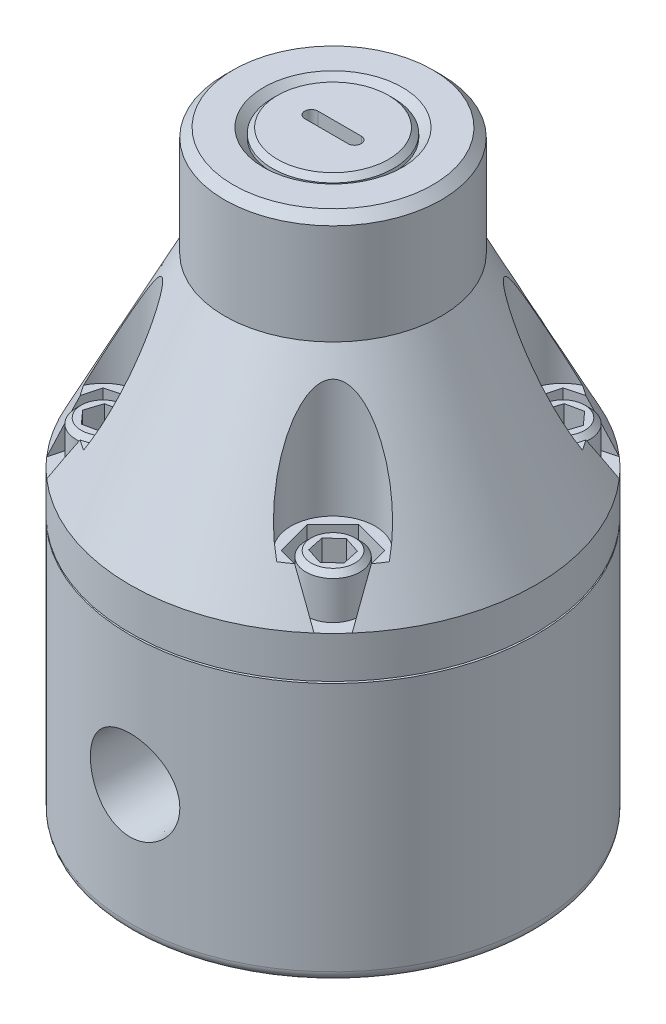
SolidWorks part; units mm, degrees
ref_plane "Front Plane" through (0, 0, 0) normal (0, 0, 1) x (1, 0, 0)
ref_plane "Top Plane" through (0, 0, 0) normal (0, 1, 0) x (1, 0, 0)
ref_plane "Right Plane" through (0, 0, 0) normal (1, 0, 0) x (0, 0, -1)
sketch "Sketch1" plane through (0, 0, 0) normal (0, 1, 0) x (1, 0, 0)
  circle A0 centre (0, 0) radius 29.718
  dimension "D1" = 59.436
extrude "Extrude1" add sketch "Sketch1" along normal blind 87.63
sketch "Sketch2" plane through (0, 0, 0) normal (0, 0, 1) x (1, 0, 0)
  line L0 (0, 0) -> (0, 87.63) construction
  line L1 (29.718, 87.63) -> (-29.718, 87.63) construction
  line L2 (-34.5439, 38.1) -> (-19.05, 38.1)
  line L3 (-19.05, 38.1) -> (-19.05, 38.354)
  line L4 (-19.05, 38.354) -> (-29.718, 38.354)
  line L5 (-15.875, 71.628) -> (-15.875, 89.2885)
  line L6 (-15.875, 89.2885) -> (-34.5439, 89.2885)
  line L7 (-34.5439, 89.2885) -> (-34.5439, 38.1)
  line L8 (-29.718, 87.63) -> (-29.718, 0) construction
  line L9 (-29.718, 38.354) -> (-29.718, 44.45)
  line L10 (-29.718, 0) -> (29.718, 0) construction
  line L11 (-29.718, 44.45) -> (-15.875, 71.628)
  dimension "D1" = 38.1
  dimension "D2" = 0.254
  dimension "D3" = 6.35
  dimension "D4" = 27.178
  dimension "D5" = 15.875
  dimension "D6" = 19.05
revolve "Cut-Revolve1" cut sketch "Sketch2" angle 360 about L0
ref_plane "Plane1" through (0, 87.63, 0) normal (0, 1, 0) x (-1, 0, 0)
sketch "Sketch3" plane through (0, 87.63, 0) normal (0, 1, 0) x (-1, 0, 0)
  circle A0 centre (0, 0) radius 10.16
  dimension "D1" = 20.32
extrude "Extrude2" cut sketch "Sketch3" against normal blind 1.27 draft 45
ref_plane "Plane2" through (0, 0, 29.718) normal (0, 0, 1) x (1, 0, 0)
sketch "Sketch4" plane through (0, 0, 29.718) normal (0, 0, 1) x (1, 0, 0)
  line L0 (0, 0) -> (0, 19.05) construction
  dimension "D1" = 19.05
hole_wizard "1/4 Rc Tapped Hole1" positions "3DSketch3" profile "Sketch6" size "1/4" standard "BSI"
sketch3d "3DSketch3"
  point P0 (0, 19.05, 29.718)
  point P4 (0, 19.05, 29.718)
sketch "Sketch6" plane through (0, 19.05, 29.718) normal (1, 0, 0) x (0, -1, 0)
  line L0 (0, 0) -> (0, 19.742)
  line L1 (5.35, 17.526) -> (0, 19.742)
  line L2 (-5.35, 17.526) -> (0, 19.742) construction
  line L3 (5.35, 17.526) -> (5.35, 10.922)
  line L4 (5.35, 10.922) -> (6.2351, 10.922)
  line L5 (6.2351, 10.922) -> (6.5761, 0)
  line L6 (-6.2351, 10.922) -> (-6.5761, 0) construction
  line L7 (6.5761, 0) -> (0, 0)
  line L8 (0, -6.35) -> (0, 107.95) construction
  line L11 (-5.35, 10.922) -> (-6.2351, 10.922) construction
  dimension "Tap Drill Dia." = 10.7
  dimension "Tap Drill Depth" = 17.526
  dimension "Thread Dia." = 13.1521
  dimension "Thread Angle" = 3.576
  dimension "Thread Depth" = 10.922
  dimension "Drill Angle" = 135
pattern_circular "CirPattern1" count 2 over 360 about axis through (0, 87.63, 0) along (0, -1, 0) of "1/4 Rc Tapped Hole1"
chamfer "Chamfer1" distance 1.27 angle 45 1 edges at (0, 87.63, 15.875)
fillet "Fillet1" radius 1.524 1 edges at (0, 0, 29.718)
sketch "Sketch7" plane through (0, 87.63, 0) normal (0, 1, 0) x (-1, 0, 0)
  circle A0 centre (0, 0) radius 8.89
extrude "Extrude4" add sketch "Sketch7" against normal up to surface (1.27 mm away)
sketch "Sketch10" plane through (0, 87.63, 0) normal (0, 1, 0) x (-1, 0, 0)
  line L0 (-3.175, 0) -> (3.175, 0) construction
  line L1 (-3.175, 0.9652) -> (3.175, 0.9652)
  line L2 (-3.175, -0.9652) -> (3.175, -0.9652)
  arc A0 (-3.175, 0.9652) -> (-3.175, -0.9652) centre (-3.175, 0) ccw
  arc A1 (3.175, 0.9652) -> (3.175, -0.9652) centre (3.175, 0) cw
  dimension "D1" = 3.175
  dimension "D2" = 6.35
  dimension "D3" = 0.9652
  dimension "D4" = 0.9652
  dimension "D5" = 3.175
  dimension "D6" = 6.35
extrude "Extrude5" cut sketch "Sketch10" against normal blind 4.7498
chamfer "Chamfer4" distance 0.762 angle 45 1 edges at (0, 87.63, 8.89)
ref_plane "Plane3" through (0, 50.8, 0) normal (0, 1, 0) x (-1, 0, 0)
sketch "Sketch11" plane through (0, 50.8, 0) normal (0, 1, 0) x (-1, 0, 0)
  line L0 (0, 0) -> (0, -29.718) construction
  line L1 (0, 0) -> (-21.0138, -21.0138) construction
  circle A0 centre (0, 0) radius 23.8125 construction
  circle A1 centre (0, 0) radius 29.718 construction
  circle A2 centre (-16.838, -16.838) radius 6.1722
  dimension "D1" = 47.625
  dimension "D3" = 12.3444
  dimension "D2" = 45
extrude "Extrude6" cut sketch "Sketch11" along normal blind 21.2598
pattern_circular "CirPattern2" count 4 over 360 about axis through (0, 0, 0) along (0, 1, 0) of "Extrude6"
sketch "Sketch12" plane through (0, 50.8, 0) normal (0, 1, 0) x (-1, 0, 0)
  line L0 (0, 0) -> (0, -29.718) construction
  line L1 (0, 0) -> (-21.0138, -21.0138) construction
  line L2 (-16.838, -16.838) -> (-13.5512, -20.1248) construction
  line L3 (-20.6256, -13.0646) -> (-23.3737, -23.3983)
  line L4 (-13.0504, -20.6114) -> (-11.6763, -15.4445)
  line L5 (-11.6763, -15.4445) -> (-15.4639, -11.6711)
  line L6 (-15.4639, -11.6711) -> (-20.6256, -13.0646)
  line L10 (-23.3737, -23.3983) -> (-13.0504, -20.6114)
  line L13 (-21.9996, -18.2314) -> (-18.2121, -22.0048)
  line L14 (-20.6256, -13.0646) -> (-21.9996, -18.2314)
  line L15 (-18.2121, -22.0048) -> (-13.0504, -20.6114)
  circle A0 centre (0, 0) radius 23.8125 construction
  circle A1 centre (0, 0) radius 29.718 construction
  circle A2 centre (-16.838, -16.838) radius 4.6482 construction
  circle A3 centre (-16.838, -16.838) radius 4.6301 construction
  dimension "D1" = 47.625
  dimension "D3" = 9.2964
  dimension "D2" = 45
  dimension "D4" = 4.6482
extrude "Extrude7" cut sketch "Sketch12" against normal blind 6.35
pattern_circular "CirPattern3" count 4 over 360 about axis through (0, 0, 0) along (0, 1, 0) of "Extrude7"
sketch "Sketch13" plane through (0, 50.8, 0) normal (0, 1, 0) x (-1, 0, 0)
  line L0 (0, 0) -> (-21.0073, -21.0203) construction
  arc A0 (-22.3577, -19.5779) -> (-19.564, -22.3698) centre (0, 0) ccw construction
  circle A1 centre (0, 0) radius 23.8125 construction
  circle A2 centre (-16.8328, -16.8432) radius 3.9624
  dimension "D1" = 7.9248
extrude "Extrude8" add sketch "Sketch13" against normal up to surface (6.35 mm away)
sketch "Sketch14" plane through (0, 50.8, 0) normal (0, 1, 0) x (-1, 0, 0)
  line L1 (-15.1431, -18.7188) -> (-14.3636, -16.3177)
  line L2 (-14.3636, -16.3177) -> (-16.0533, -14.4421)
  line L3 (-16.0533, -14.4421) -> (-18.5224, -14.9676)
  line L4 (-18.5224, -14.9676) -> (-19.3019, -17.3687)
  line L5 (-19.3019, -17.3687) -> (-17.6123, -19.2443)
  line L6 (-17.6123, -19.2443) -> (-15.1431, -18.7188)
  circle A0 centre (-16.8328, -16.8432) radius 2.1862 construction
extrude "Extrude9" cut sketch "Sketch14" against normal blind 3.175
chamfer "Chamfer5" distance 0.762 angle 45 1 edges at (16.8328, 50.8, -12.8808)
pattern_circular "CirPattern4" count 4 over 360 about axis through (0, 0, 0) along (0, 1, 0) of "Extrude8", "Extrude9", "Chamfer5"
